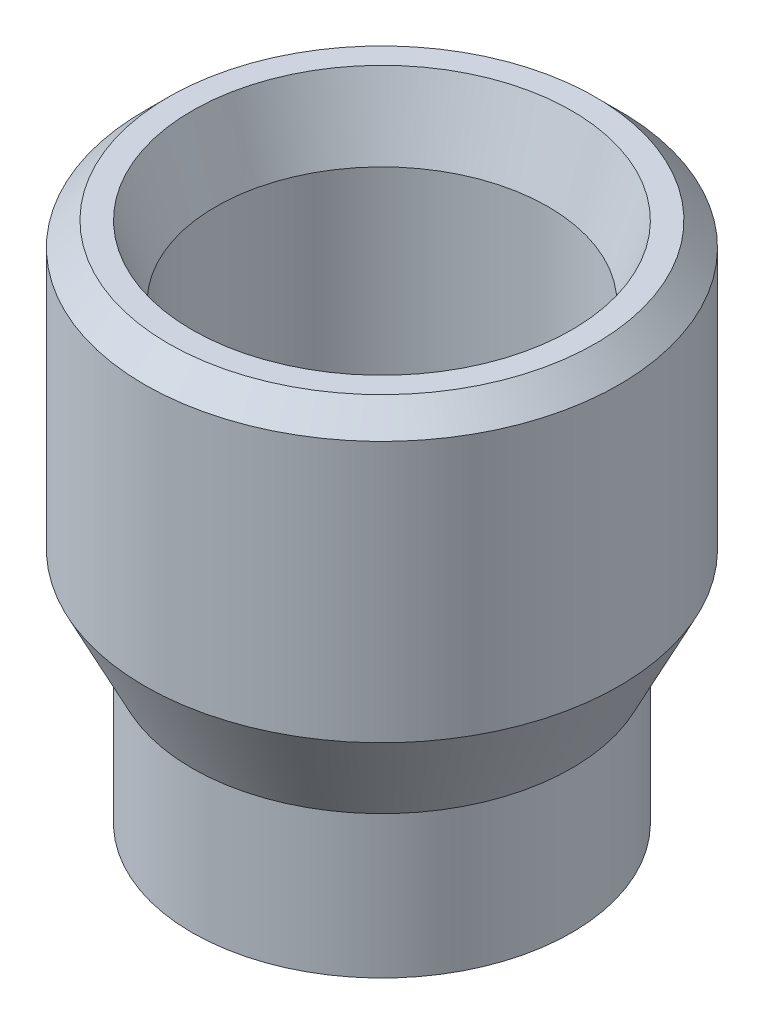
SolidWorks part; units mm, degrees
ref_plane "Přední rovina" through (0, 0, 0) normal (0, 0, 1) x (1, 0, 0)
ref_plane "Horní rovina" through (0, 0, 0) normal (0, 1, 0) x (1, 0, 0)
ref_plane "Pravá rovina" through (0, 0, 0) normal (1, 0, 0) x (0, 0, -1)
sketch "Skica1" plane through (0, 0, 0) normal (0, 1, 0) x (1, 0, 0)
  circle A0 centre (0, 0) radius 8
extrude "Přidat vysunutím1" add sketch "Skica1" along normal blind 10
sketch "Skica2" plane through (0, 10, 0) normal (0, 1, 0) x (-1, 0, 0)
  circle A0 centre (0, 0) radius 10
extrude "Přidat vysunutím2" add sketch "Skica2" along normal blind 12
chamfer "Zkosení1" distance 4 distance2 2 1 edges at (0, 10, 8)
chamfer "Zkosení2" distance 1 distance2 1 1 edges at (0, 22, 10)
sketch "Skica3" plane through (0, 0, 0) normal (0, -1, 0) x (1, 0, 0)
  circle A0 centre (0, 0) radius 3.5
extrude "Odebrat vysunutím1" cut sketch "Skica3" against normal blind 11
sketch "Skica4" plane through (0, 22, 0) normal (0, 1, 0) x (-1, 0, 0)
  circle A0 centre (0, 0) radius 7
extrude "Odebrat vysunutím2" cut sketch "Skica4" against normal blind 11
chamfer "Zkosení3" distance 1 distance2 3 1 edges at (0, 22, 7)
